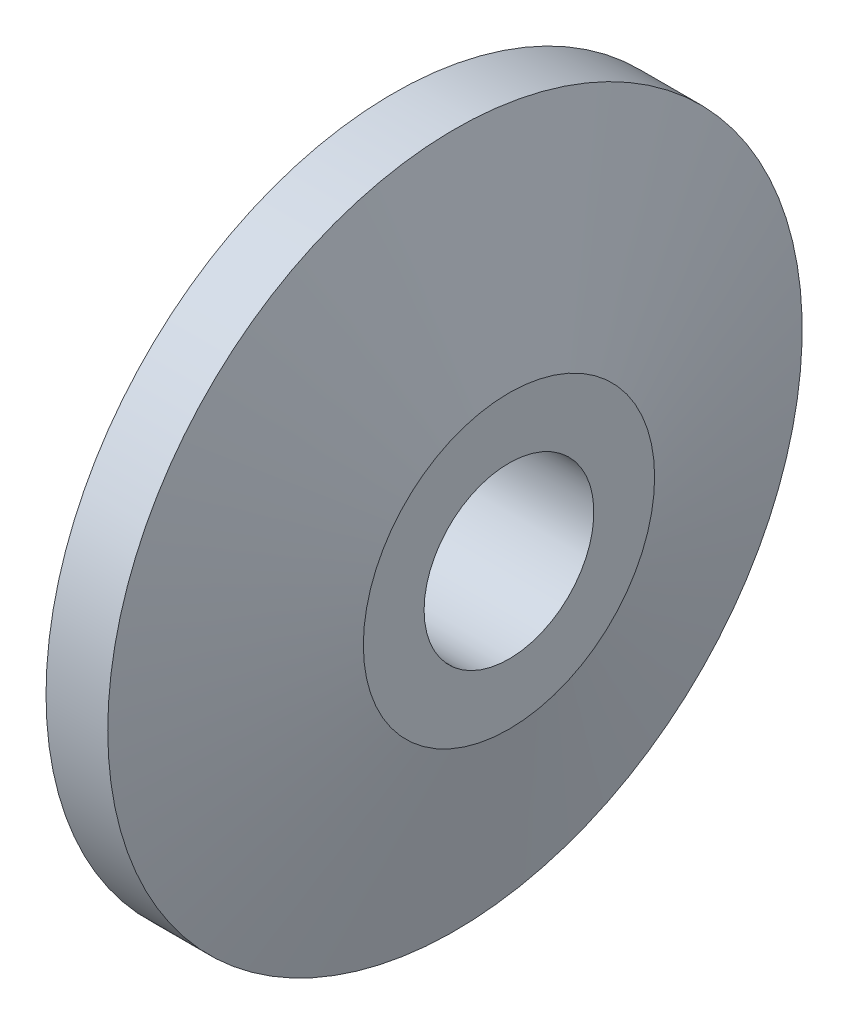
SolidWorks part; units mm, degrees
ref_plane "Plan de face" through (0, 0, 0) normal (0, 0, 1) x (1, 0, 0)
ref_plane "Plan de dessus" through (0, 0, 0) normal (0, 1, 0) x (1, 0, 0)
ref_plane "Plan de droite" through (0, 0, 0) normal (1, 0, 0) x (0, 0, -1)
sketch "Esquisse1" plane through (0, 0, 0) normal (0, 0, 1) x (1, 0, 0)
  line L0 (0, 0) -> (51.1439, 0) construction
  line L1 (0, 11) -> (28, 11)
  line L2 (28, 11) -> (28, 18.8756)
  line L3 (28, 18.8756) -> (21, 45)
  line L4 (21, 45) -> (13, 45)
  line L5 (13, 45) -> (13, 25)
  line L6 (13, 25) -> (0, 25)
  line L7 (0, 25) -> (0, 11)
  dimension "D1" = 28
  dimension "D2" = 13
  dimension "D3" = 11
  dimension "D4" = 50
  dimension "D5" = 90
  dimension "D6" = 15
  dimension "D7" = 8
revolve "Révolution1" add sketch "Esquisse1" angle 360 about L0
